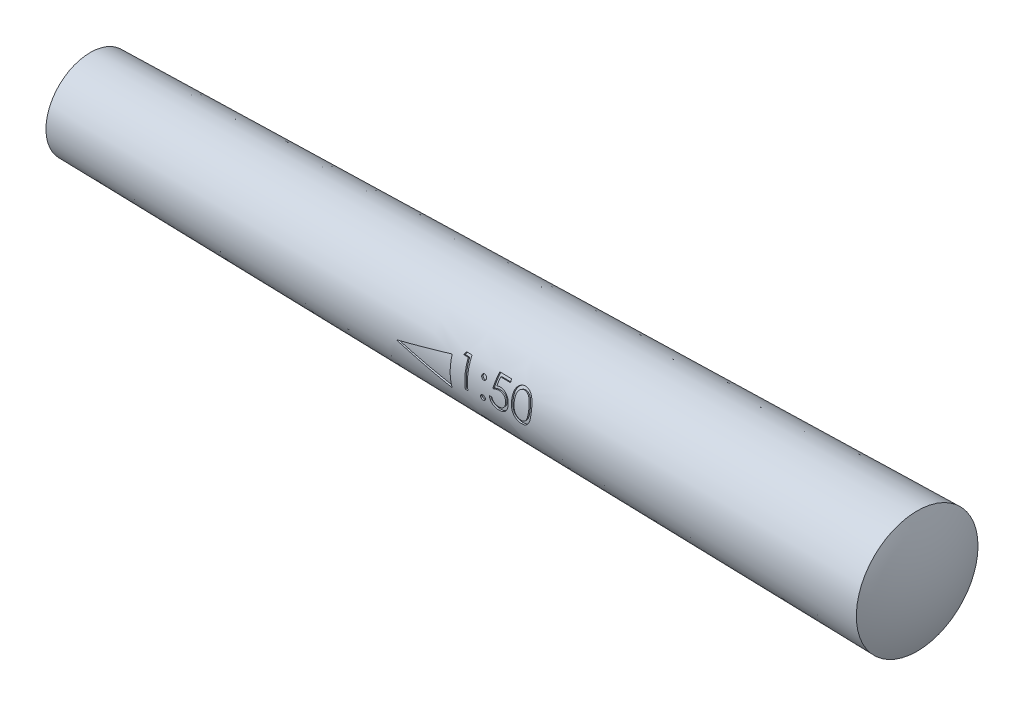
SolidWorks part; units mm, degrees
ref_plane "Front Plane" through (0, 0, 0) normal (0, 0, 1) x (1, 0, 0)
ref_plane "Top Plane" through (0, 0, 0) normal (0, 1, 0) x (1, 0, 0)
ref_plane "Right Plane" through (0, 0, 0) normal (1, 0, 0) x (0, 0, -1)
sketch "Sketch1" plane through (0, 0, 0) normal (1, 0, 0) x (0, 0, -1)
  circle A0 centre (0, 0) radius 1.5
  dimension "D1" = 3
extrude "Extrude1" add sketch "Sketch1" along normal mid plane 28
draft "Draft1" type of draft neutral plane draft angle 1.146 faces to draft 1 parameters "D1"=1.146
sketch "Sketch2" plane through (0, 0, 0) normal (0, 0, 1) x (1, 0, 0)
  line L0 (-14, 0) -> (-14, 1.5)
  line L1 (-14, 1.5) -> (-14, -1.5) construction
  line L2 (-14, 0) -> (-14.45, 0)
  line L3 (-14.45, 0) -> (-14.45, -1.78) construction
  line L4 (14, 0) -> (14, 2.06)
  line L5 (14, -2.06) -> (14, 2.06) construction
  line L6 (14, 0) -> (14.45, 0)
  line L7 (14.45, 0) -> (14.45, -1.78) construction
  line L8 (-14, -1.5) -> (14, -2.06) construction
  arc A0 (-14.45, 0) -> (-14, 1.5) centre (-11.725, 0) cw
  arc A1 (14.45, 0) -> (14, 2.06) centre (9.5098, 0) ccw
  point P14 (0, -1.78)
revolve "Revolve1" add sketch "Sketch2" angle 360 about L2
sketch "Sketch5" plane through (0, 0, 0) normal (0, 0, 1) x (1, 0, 0)
  line L0 (0, 1.78) -> (0, -1.78) construction
  line L1 (14, 2.06) -> (-14, 1.5) construction
  line L2 (-14, -1.5) -> (14, -2.06) construction
ref_plane "Plane2" through (0, 0, 0) normal (-0.02, 0, 0.9998) x (0.9998, 0, 0.02)
sketch "Sketch6" plane through (0, 0, 0) normal (-0.02, 0, 0.9998) x (0.9998, 0, 0.02)
  line L0 (0, 0) -> (0, 0.5)
  line L1 (0, 1.78) -> (0, -1.78) construction
  line L2 (0, 0.5) -> (-1.866, 0)
  line L3 (-1.866, 0) -> (0, -0.5)
  line L4 (0, -0.5) -> (0, 0)
  line L5 (0, -0.25) -> (3, -0.25) construction
  text T0 "1:50" font "Century Gothic" height 1
  dimension "D1" = 1
  dimension "D2" = 30
  dimension "D3" = 3
wrap "Wrap2" sketch "Sketch6" wrap type deboss source sketch "Sketch6" thickness 0.05 parameters "D1"=0.05
equation "\"D2@Sketch2\" = \"D1@Sketch2\""
